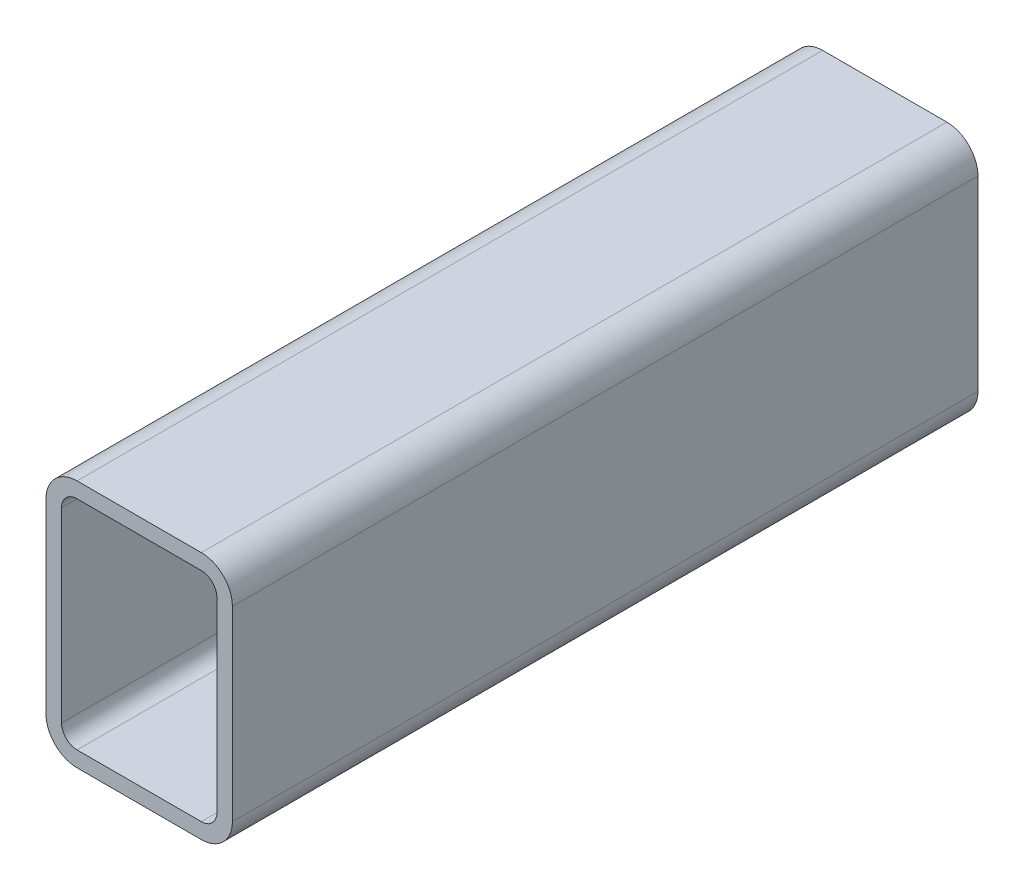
SolidWorks part; units mm, degrees
ref_plane "Front Plane" through (0, 0, 0) normal (0, 0, 1) x (1, 0, 0)
ref_plane "Top Plane" through (0, 0, 0) normal (0, 1, 0) x (1, 0, 0)
ref_plane "Right Plane" through (0, 0, 0) normal (1, 0, 0) x (0, 0, -1)
sketch "Sketch1" plane through (0, 0, 0) normal (0, 0, 1) x (1, 0, 0)
sketch_block_instance "HSS4x3x0.250-1"
sketch_block "HSS4x3x0.250"
extrude "Boss-Extrude1" add sketch "Sketch1" along normal blind 304.8
